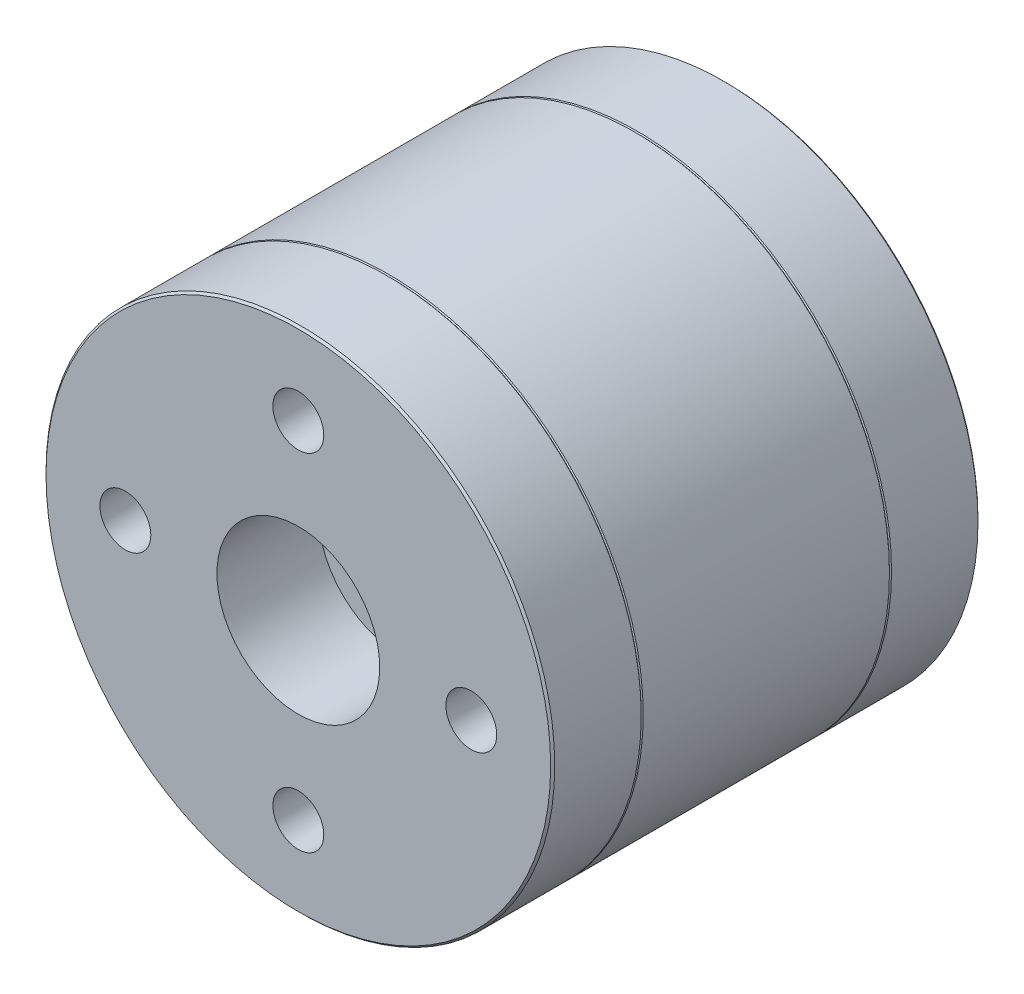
SolidWorks part; units mm, degrees
ref_plane "Front Plane" through (0, 0, 0) normal (0, 0, 1) x (1, 0, 0)
ref_plane "Top Plane" through (0, 0, 0) normal (0, 1, 0) x (1, 0, 0)
ref_plane "Right Plane" through (0, 0, 0) normal (1, 0, 0) x (0, 0, -1)
sketch "Sketch1" plane through (0, 0, 0) normal (0, 0, 1) x (1, 0, 0)
  circle A0 centre (0, 0) radius 12.5
  dimension "D1" = 25
extrude "Boss-Extrude1" add sketch "Sketch1" along normal mid plane 21
ref_axis "Axis1" through (0, 0, 10.5) along (0, 0, -1)
sketch "Sketch2" plane through (0, 0, 0) normal (1, 0, 0) x (0, 0, -1)
  line L0 (-6.15, 12.5) -> (-6.05, 12.5)
  line L1 (10.5, 12.5) -> (-10.5, 12.5) construction
  line L2 (-6.05, 12.5) -> (-6.1, 12.45)
  line L3 (-6.1, 12.45) -> (-6.15, 12.5)
  line L4 (6.05, 12.5) -> (6.15, 12.5)
  line L5 (6.15, 12.5) -> (6.1, 12.45)
  line L6 (6.1, 12.45) -> (6.05, 12.5)
  line L7 (10.5, -12.5) -> (10.5, 12.5) construction
  line L8 (-10.5, 12.5) -> (-10.5, -12.5) construction
  dimension "D1" = 0.1
  dimension "D2" = 4.4
  dimension "D3" = 4.4
revolve "Cut-Revolve1" cut sketch "Sketch2" angle 360 about axis through (0, 0, 10.5) along (0, 0, -1)
chamfer "Chamfer1" distance 0.1 angle 45 2 edges at (12.5, 0, -10.5) (12.5, 0, 10.5)
sketch "Sketch4" plane through (0, 0, -10.5) normal (0, 0, -1) x (-1, 0, 0)
  circle A0 centre (0, 0) radius 3.51
  dimension "D1" = 7.02
extrude "Cut-Extrude1" cut sketch "Sketch4" against normal blind 1
sketch "Sketch5" plane through (0, 0, -9.5) normal (0, 0, -1) x (-1, 0, 0)
  circle A0 centre (0, 0) radius 3.5
  dimension "D1" = 7
extrude "Boss-Extrude2" add sketch "Sketch5" along normal blind 3.5
sketch "Sketch6" plane through (0, 0, -13) normal (0, 0, -1) x (-1, 0, 0)
  circle A0 centre (0, 0) radius 2
  dimension "D1" = 4
extrude "Cut-Extrude2" cut sketch "Sketch6" against normal up to next
sketch "Sketch7" plane through (0, 0, 10.5) normal (0, 0, 1) x (1, 0, 0)
  circle A0 centre (0, 0) radius 4
  dimension "D1" = 8
extrude "Cut-Extrude3" cut sketch "Sketch7" against normal blind 5
chamfer "Chamfer2" distance 0.2 angle 45 2 edges at (-3.5, 0, -13) (-2, 0, -13)
sketch "Sketch8" plane through (0, 0, -10.5) normal (0, 0, -1) x (-1, 0, 0)
  circle A0 centre (0, 8.5) radius 1.25
  circle A1 centre (8.5, 0) radius 1.25
  circle A2 centre (0, -8.5) radius 1.25
  circle A3 centre (-8.5, 0) radius 1.25
  point P12 (0, 0)
  dimension "D2" = 2.5
  dimension "D1" = 8.5
  dimension "D3" = 4
extrude "Cut-Extrude4" cut sketch "Sketch8" against normal up to next
sketch "Sketch9" plane through (0, 0, -10.5) normal (0, 0, -1) x (-1, 0, 0)
  circle A0 centre (-8.5, 0) radius 2.5
  circle A1 centre (8.5, 0) radius 2.5
  dimension "D1" = 5
extrude "Cut-Extrude5" cut sketch "Sketch9" against normal blind 3
chamfer "Chamfer3" distance 0.25 angle 45 2 edges at (-11, 0, -10.5) (6, 0, -10.5)
